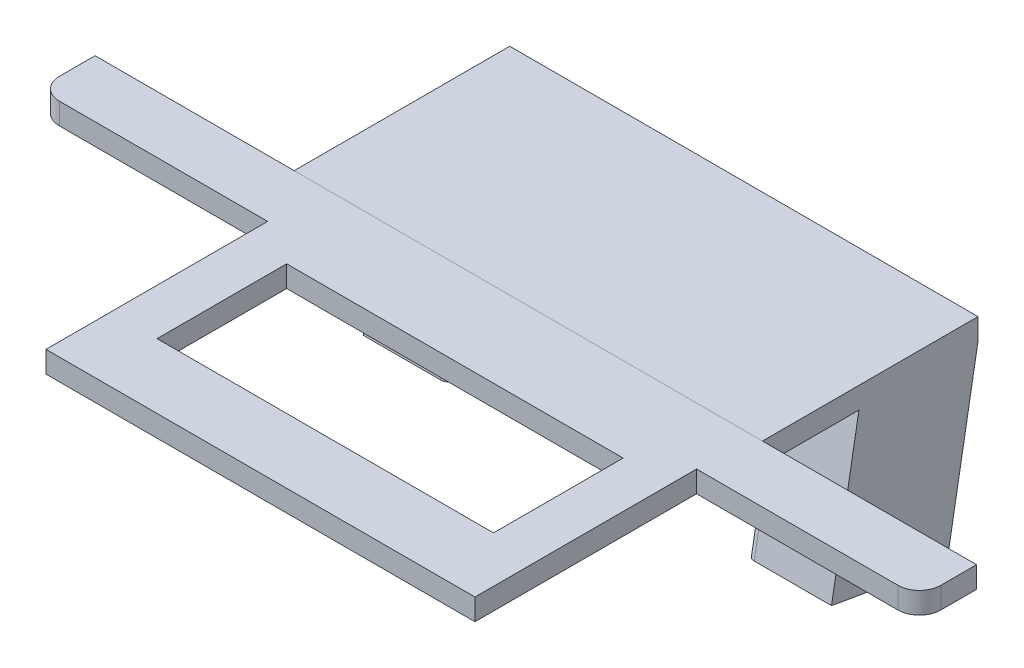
SolidWorks part; units mm, degrees
ref_plane "Plano frontal" through (0, 0, 0) normal (0, 0, 1) x (1, 0, 0)
ref_plane "Plano superior" through (0, 0, 0) normal (0, 1, 0) x (1, 0, 0)
ref_plane "Plano direito" through (0, 0, 0) normal (1, 0, 0) x (0, 0, -1)
sketch "Esboço1" plane through (0, 0, 0) normal (0, 1, 0) x (1, 0, 0)
  line L1 (0, 0) -> (60, 0)
  line L2 (0, 0) -> (0, -35)
  line L3 (0, -35) -> (60, -35)
  line L4 (60, 0) -> (60, -35)
  dimension "D1" = 35
  dimension "D2" = 60
extrude "Ressalto-extrusão1" add sketch "Esboço1" along normal blind 3 contours L3 L4 L1 L2
sketch "Esboço5" plane through (0, 0, 0) normal (0, -1, 0) x (1, 0, 0)
  line L3 (-32.1358, 4) -> (91.1642, 4)
  line L4 (-32.1358, 4) -> (-32.1358, -4)
  line L5 (-32.1358, -4) -> (91.1642, -4)
  line L6 (91.1642, 4) -> (91.1642, -4)
  line L7 (-32.1358, 4) -> (91.1642, -4) construction
  line L8 (-32.1358, -4) -> (91.1642, 4) construction
  dimension "D1" = 123.3
  dimension "D2" = 8
extrude "Ressalto-extrusão2" add sketch "Esboço5" against normal blind 3
ref_plane "Plano2" through (-32.1358, 3, -4) normal (0, -1, 0) x (-1, 0, 0)
fillet "Filete2" radius 3 1 edges at (-32.1358, 1.5, 4)
fillet "Filete4" radius 3 1 edges at (91.1642, 1.5, 4)
sketch "Esboço10" plane through (0, 0, 0) normal (0, -1, 0) x (1, 0, 0)
  line L0 (29.5142, -4) -> (29.5142, -3.15)
  line L1 (-32.1358, -4) -> (91.1642, -4) construction
  line L3 (-4.2858, -3.15) -> (61.2142, -3.15)
  line L4 (-4.2858, -3.15) -> (-4.2858, -34.15)
  line L5 (-4.2858, -34.15) -> (61.2142, -34.15)
  line L6 (61.2142, -3.15) -> (61.2142, -34.15)
  dimension "D1" = 31
  dimension "D2" = 65.5
  dimension "D3" = 27.85
  dimension "D4" = 29.95
extrude "Ressalto-extrusão3" add sketch "Esboço10" against normal blind 3 separate body contours L6 L3 L4 L5
ref_plane "Plano8" through (0, 5.84, -1.0297) normal (0, -0.9848, 0.1736) x (-1, 0, 0)
sketch "Esboço28" plane through (0, 5.84, -1.0297) normal (0, -0.9848, 0.1736) x (-1, 0, 0)
  line L1 (-61.2142, 33.6312) -> (4.2858, 33.6312)
  line L2 (-61.2142, 33.6312) -> (-61.2142, 17.2312)
  line L3 (-61.2142, 17.2312) -> (4.2858, 17.2312)
  line L4 (4.2858, 33.6312) -> (4.2858, 17.2312)
  dimension "D1" = 65.5
  dimension "D2" = 16.4
extrude "Ressalto-extrusão7" add sketch "Esboço28" along normal blind 25
sketch "Esboço29" plane through (0, -18.7802, 3.3115) normal (0, -0.9848, 0.1736) x (-1, 0, 0)
  line L0 (-7.5142, 33.6312) -> (-7.5142, 31.6312)
  line L1 (4.2858, 33.6312) -> (-61.2142, 33.6312) construction
  line L2 (-7.5142, 31.6312) -> (2.4858, 31.6312)
  line L3 (2.4858, 31.6312) -> (2.4858, 19.2312)
  line L4 (2.4858, 19.2312) -> (-7.5142, 19.2312)
  line L5 (-7.5142, 19.2312) -> (-7.5142, 17.2312)
  line L6 (-61.2142, 17.2312) -> (4.2858, 17.2312) construction
  line L7 (-7.5142, 17.2312) -> (-49.4142, 17.2312)
  line L8 (-49.4142, 17.2312) -> (-49.4142, 19.2312)
  line L9 (-49.4142, 19.2312) -> (-59.4142, 19.2312)
  line L10 (-59.4142, 19.2312) -> (-59.4142, 31.6312)
  line L11 (-59.4142, 31.6312) -> (-49.4142, 31.6312)
  line L12 (-49.4142, 31.6312) -> (-49.4142, 33.6312)
  line L13 (-49.4142, 33.6312) -> (-7.5142, 33.6312)
  line L14 (4.2858, 17.2312) -> (4.2858, 33.6312) construction
  line L15 (-61.2142, 33.6312) -> (-61.2142, 17.2312) construction
  dimension "D1" = 1.8
  dimension "D2" = 2
  dimension "D3" = 10
  dimension "D4" = 10
  dimension "D5" = 2
  dimension "D6" = 1.8
  dimension "D7" = 10
  dimension "D8" = 10
  dimension "D9" = 2
  dimension "D10" = 2
extrude "Corte-extrusão3" cut sketch "Esboço29" against normal blind 22
fillet "Filete7" radius 1 1 edges at (7.5142, -13.44, -29.7493)
fillet "Filete8" radius 1 1 edges at (7.5142, -13.7873, -31.7189)
fillet "Filete9" radius 1 1 edges at (7.5142, -10.9395, -15.5681)
fillet "Filete10" radius 1 1 edges at (7.5142, -11.2868, -17.5377)
fillet "Filete11" radius 1 1 edges at (49.4142, -13.44, -29.7493)
fillet "Filete12" radius 1 1 edges at (49.4142, -13.7873, -31.7189)
fillet "Filete13" radius 1 1 edges at (49.4142, -11.2868, -17.5377)
fillet "Filete14" radius 1 1 edges at (49.4142, -10.9395, -15.5681)
sketch "Esboço30" plane through (0, 0, 0) normal (0, -1, 0) x (-1, 0, 0)
  line L3 (-53.5315, -7.8083) -> (-6.4685, -7.8083)
  line L4 (-53.5315, -7.8083) -> (-53.5315, -25.9361)
  line L5 (-53.5315, -25.9361) -> (-6.4685, -25.9361)
  line L6 (-6.4685, -7.8083) -> (-6.4685, -25.9361)
  line L7 (-53.5315, -7.8083) -> (-6.4685, -25.9361) construction
  line L8 (-53.5315, -25.9361) -> (-6.4685, -7.8083) construction
extrude "Corte-extrusão4" cut sketch "Esboço30" against normal blind 10
